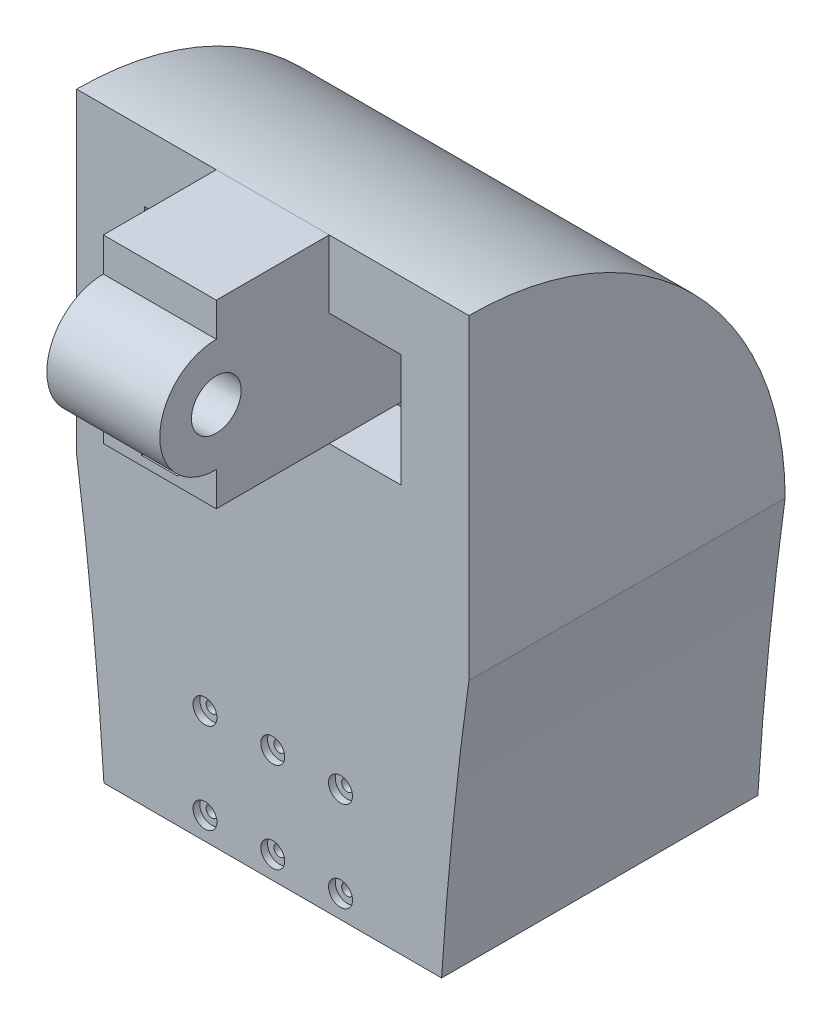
SolidWorks part; units mm, degrees
ref_plane "前视基准面" through (0, 0, 0) normal (0, 0, 1) x (1, 0, 0)
ref_plane "上视基准面" through (0, 0, 0) normal (0, 1, 0) x (1, 0, 0)
ref_plane "右视基准面" through (0, 0, 0) normal (1, 0, 0) x (0, 0, -1)
other "Configuration Table"
sketch "草图2" plane through (0, 0, 0) normal (0, 0, 1) x (1, 0, 0)
  line L1 (0, 0) -> (140, 0)
  line L2 (0, 0) -> (0, 60)
  line L3 (0, 60) -> (140, 60)
  line L4 (140, 0) -> (140, 60)
  line L5 (-30, 110) -> (170, 110)
  line L6 (-30, 110) -> (-30, -3)
  line L7 (-30, -3) -> (170, -3)
  line L8 (170, 110) -> (170, -3)
  dimension "D1" = 140
  dimension "D2" = 60
  dimension "D3" = 30
  dimension "D4" = 30
  dimension "D5" = 50
  dimension "D6" = 3
extrude "凸台-拉伸2" add sketch "草图2" along normal blind 90
sketch "草图4" plane through (0, -3, 0) normal (0, -1, 0) x (1, 0, 0)
  line L4 (-30, 0) -> (170, 0)
  line L5 (170, 0) -> (170, 90)
  line L6 (170, 90) -> (-30, 90)
  line L7 (-30, 90) -> (-30, 0)
  line L8 (-30, 0) -> (170, 0)
  line L9 (170, 0) -> (170, 90)
  line L10 (170, 90) -> (-30, 90)
  line L11 (-30, 90) -> (-30, 0)
  dimension "D1" = 0
extrude "切除-拉伸2" cut sketch "草图4" against normal blind 3
sketch "草图5" plane through (0, 110, 0) normal (0, 1, 0) x (1, 0, 0)
  line L0 (140, -7.5) -> (132.5, -7.5)
  line L1 (132.5, -7.5) -> (132.5, 0)
  line L2 (132.5, -7.5) -> (112.5, -7.5) construction
  line L3 (132.5, -7.5) -> (132.5, -17.5) construction
  line L4 (140, 0) -> (0, 0)
  line L5 (140, -90) -> (140, 0)
  line L6 (0, -90) -> (140, -90)
  line L7 (0, 0) -> (0, -90)
  line L8 (140, 0) -> (0, 0)
  line L9 (140, -90) -> (140, 0)
  line L10 (0, -90) -> (140, -90)
  line L11 (0, 0) -> (0, -90)
  line L12 (70, 0) -> (70, -50000) construction
  circle A0 centre (132.5, -7.5) radius 1.5
  circle A1 centre (112.5, -7.5) radius 1.5
  circle A2 centre (112.5, -17.5) radius 1.5
  circle A3 centre (132.5, -17.5) radius 1.5
  circle A4 centre (27.5, -7.5) radius 1.5
  circle A5 centre (7.5, -7.5) radius 1.5
  circle A6 centre (7.5, -17.5) radius 1.5
  circle A7 centre (27.5, -17.5) radius 1.5
  point P19 (70, 0)
  dimension "D4" = 3
  dimension "D2" = 7.5
  dimension "D3" = 7.5
  dimension "D7" = 20
  dimension "D8" = 10
  dimension "D9" = 20
  dimension "D1" = 0
  dimension "D5" = 2
  dimension "D6" = 2
extrude "切除-拉伸3" cut sketch "草图5" against normal through all contours A6 | A7 | A4 | A5 | A0 | A1 | A2 | A3
sketch "草图6" plane through (0, 0, 0) normal (0, 0, -1) x (-1, 0, 0)
  line L0 (-170, 80) -> (30, 80)
  line L8 (0, 0) -> (30, 0)
  line L9 (30, 0) -> (30, 110)
  line L10 (30, 110) -> (-170, 110)
  line L11 (-170, 110) -> (-170, 0)
  line L12 (-170, 0) -> (-140, 0)
  line L13 (-140, 0) -> (-140, 60)
  line L14 (-140, 60) -> (0, 60)
  line L15 (0, 60) -> (0, 0)
  line L16 (0, 0) -> (30, 0)
  line L17 (30, 0) -> (30, 110)
  line L18 (30, 110) -> (-170, 110)
  line L19 (-170, 110) -> (-170, 0)
  line L20 (-170, 0) -> (-140, 0)
  line L21 (-140, 0) -> (-140, 60)
  line L22 (-140, 60) -> (0, 60)
  line L23 (0, 60) -> (0, 0)
  dimension "D2" = 30
  dimension "D1" = 0
extrude "凸台-拉伸4" add sketch "草图6" along normal blind 50 contours L0 M13 M11 M12
sketch "草图7" plane through (0, 0, -50) normal (0, 0, -1) x (-1, 0, 0)
  line L0 (30, 110) -> (30, 710)
  line L1 (30, 710) -> (-170, 710)
  line L2 (-170, 710) -> (-170, 110)
  line L3 (-70, 710) -> (-70, -49290) construction
  line L4 (-170, 110) -> (-170, 80)
  line L5 (-170, 80) -> (30, 80)
  line L6 (30, 80) -> (30, 110)
  line L7 (30, 110) -> (-170, 110)
  line L8 (-170, 110) -> (-170, 80)
  line L9 (-170, 80) -> (30, 80)
  line L10 (30, 80) -> (30, 110)
  line L11 (30, 110) -> (-170, 110)
  line L12 (-170, 710) -> (-140, 710) construction
  arc A0 (-170, 710) -> (-170, 110) centre (-1741.6234, 410) cw
  arc A1 (30, 710) -> (30, 110) centre (1601.6234, 410) ccw
  arc A2 (-140, 710) -> (-140, 110) centre (-1711.6234, 410) cw
  arc A3 (0, 710) -> (0, 110) centre (1571.6234, 410) ccw
  point P9 (-70, 710)
  dimension "D3" = 1600
  dimension "D2" = 600
  dimension "D5" = 30
  dimension "D1" = 0
  dimension "D4" = 2
extrude "凸台-拉伸5" add sketch "草图7" against normal blind 130 separate body contours A2 L1 A0 L11 | L1 A3 A1 M10
sketch "草图8" plane through (0, 0, -50) normal (0, 0, -1) x (-1, 0, 0)
  line L0 (-170, 110) -> (-170, 410)
  line L1 (-170, 410) -> (-141.6234, 410)
  line L2 (-140, 710) -> (-170, 710)
  line L3 (-170, 110) -> (-140, 110)
  line L4 (-140, 710) -> (-170, 710)
  line L5 (-170, 110) -> (-140, 110)
  line L6 (-140, 710) -> (-10, 710)
  line L7 (-140, 110) -> (0, 110)
  line L9 (30, 710) -> (0, 710)
  line L10 (0, 110) -> (30, 110)
  line L11 (30, 710) -> (0, 710)
  line L12 (0, 110) -> (30, 110)
  arc A2 (-140, 110) -> (-140, 710) centre (-1711.6234, 410) ccw
  arc A3 (-170, 110) -> (-170, 710) centre (-1741.6234, 410) ccw
  arc A4 (-140, 110) -> (-140, 710) centre (-1711.6234, 410) ccw
  arc A5 (-170, 110) -> (-170, 710) centre (-1741.6234, 410) ccw
  arc A6 (0, 710) -> (0, 110) centre (1571.6234, 410) ccw
  arc A7 (30, 710) -> (30, 110) centre (1601.6234, 410) ccw
  arc A8 (0, 710) -> (0, 110) centre (1571.6234, 410) ccw
  arc A9 (30, 710) -> (30, 110) centre (1601.6234, 410) ccw
  dimension "D2" = 0
  dimension "D1" = 0
sketch "草图9" plane through (0, 0, 80) normal (0, 0, 1) x (1, 0, 0)
  line L2 (0, 710) -> (-30, 710)
  line L3 (-30, 110) -> (0, 110)
  line L4 (0, 710) -> (-30, 710)
  line L5 (-30, 110) -> (0, 110)
  line L6 (140, 110) -> (170, 110)
  line L7 (170, 710) -> (140, 710)
  line L8 (140, 110) -> (170, 110)
  line L9 (170, 710) -> (140, 710)
  arc A2 (-30, 110) -> (-30, 710) centre (-1601.6234, 410) ccw
  arc A3 (0, 110) -> (0, 710) centre (-1571.6234, 410) ccw
  arc A4 (-30, 110) -> (-30, 710) centre (-1601.6234, 410) ccw
  arc A5 (0, 110) -> (0, 710) centre (-1571.6234, 410) ccw
  arc A6 (140, 710) -> (140, 110) centre (1711.6234, 410) ccw
  arc A7 (170, 710) -> (170, 110) centre (1741.6234, 410) ccw
  arc A8 (140, 710) -> (140, 110) centre (1711.6234, 410) ccw
  arc A9 (170, 710) -> (170, 110) centre (1741.6234, 410) ccw
  dimension "D1" = 0
  dimension "D2" = 0
extrude "凸台-拉伸6" add sketch "草图9" along normal blind 10
sketch "草图10" plane through (0, 0, 90) normal (0, 0, 1) x (1, 0, 0)
  line L0 (70, 110) -> (70, 310)
  line L1 (140, 110) -> (0, 110) construction
  line L2 (70, 310) -> (70, 450)
  line L3 (70, 450) -> (70, 510)
  line L4 (70, 510) -> (70, 570)
  line L5 (-322.3314, 450) -> (529.2566, 450)
  line L6 (70, 450) -> (-322.3314, 450)
  line L7 (70, 450) -> (70, 110)
  line L8 (70, 110) -> (-322.3314, 110)
  line L9 (-322.3314, 450) -> (-322.3314, 110)
  line L10 (70, 450) -> (529.2566, 450)
  line L11 (70, 450) -> (70, -23.1696)
  line L12 (70, -23.1696) -> (529.2566, -23.1696)
  line L13 (529.2566, 450) -> (529.2566, -23.1696)
  line L14 (-322.3314, 110) -> (-305.3602, 110)
  line L22 (70, 110) -> (-322.3314, 110)
  line L23 (70, 110) -> (70, -23.1696)
  line L24 (70, -23.1696) -> (-322.3314, -23.1696)
  line L25 (-322.3314, 110) -> (-322.3314, -23.1696)
  dimension "D1" = 200
  dimension "D2" = 140
  dimension "D3" = 60
  dimension "D4" = 60
extrude "切除-拉伸8" cut sketch "草图10" against normal blind 150 contours L5 L9 L8 M18 | L5 L0 L2 M16 M15 | L5 L2 L0 M15 M14 | L8 L5 M16 M18 | L11 L5 M15 M8 M9 M10 M11 M12 M14 | L13 L5 L11 L12 M12 M11 M10 M9 M8 | L11 L8 M15 M5 M6 M7 M8
sketch "草图11" plane through (0, 0, 90) normal (0, 0, 1) x (1, 0, 0)
  line L0 (12.8766, 450) -> (12.8766, 510)
  line L1 (-30, 710) -> (-30, 630)
  line L2 (-2.1234, 450) -> (27.8766, 450)
  line L3 (0, 710) -> (-30, 710)
  line L5 (0, 710) -> (-30, 710)
  line L6 (112.1234, 450) -> (142.1234, 450)
  line L7 (170, 710) -> (140, 710)
  line L9 (170, 710) -> (140, 710)
  line L10 (-30, 630) -> (216.8414, 630)
  line L11 (216.8414, 630) -> (216.8414, 710)
  line L12 (216.8414, 710) -> (-30, 710)
  line L17 (-2.1234, 450) -> (27.8766, 450)
  line L18 (112.1234, 450) -> (142.1234, 450)
  arc A2 (-2.1234, 450) -> (-30, 710) centre (-1601.6234, 410) ccw
  arc A3 (27.8766, 450) -> (0, 710) centre (-1571.6234, 410) ccw
  arc A4 (-2.1234, 450) -> (-30, 710) centre (-1601.6234, 410) ccw
  arc A5 (27.8766, 450) -> (0, 710) centre (-1571.6234, 410) ccw
  arc A6 (140, 710) -> (112.1234, 450) centre (1711.6234, 410) ccw
  arc A7 (170, 710) -> (142.1234, 450) centre (1741.6234, 410) ccw
  arc A8 (140, 710) -> (112.1234, 450) centre (1711.6234, 410) ccw
  arc A9 (170, 710) -> (142.1234, 450) centre (1741.6234, 410) ccw
  dimension "D3" = 60
  dimension "D4" = 80
  dimension "D1" = 0
  dimension "D2" = 0
extrude "切除-拉伸9" cut sketch "草图11" against normal blind 140 contours L12 A9 L10 L11 | A9 L9 A8 L10 | A8 L12 L10 M13 | L10 M11 M13 M14
sketch "草图17" plane through (0, 630, 0) normal (0, 1, 0) x (1, 0, 0)
  line L0 (-16.8205, -90) -> (13.1795, -90) construction
  line L1 (-16.8205, 50) -> (-15.8205, 50)
  line L2 (-16.8205, 50) -> (-16.8205, -90)
  line L3 (-16.8205, -90) -> (-15.8205, -90)
  line L4 (-15.8205, 50) -> (-15.8205, -90)
  dimension "D1" = 1
extrude "凸台-拉伸9" add sketch "草图17" along normal blind 10
sketch "草图18" plane through (-15.8205, 0, 0) normal (1, 0, 0) x (0, 0, -1)
  line L0 (-90, 770) -> (-90, 630)
  line L1 (50, 630) -> (-90, 630)
  line L2 (-90, 630) -> (-90, 770)
  line L4 (-90, 630) -> (50, 630)
  line L5 (50, 630) -> (50, 640)
  line L6 (50, 640) -> (-90, 640)
  line L7 (-90, 640) -> (-90, 630)
  line L8 (-90, 630) -> (50, 630)
  line L9 (50, 630) -> (50, 640)
  line L10 (50, 640) -> (-90, 640)
  line L11 (-90, 640) -> (-90, 630)
  arc A0 (50, 630) -> (-90, 770) centre (-90, 630) ccw
  dimension "D2" = 140
  dimension "D1" = 0
extrude "凸台-拉伸10" add sketch "草图18" along normal up to vertex (172.6411 mm away) separate body contours L10 A0 L0 | A0 L10 M5 M8
sketch "草图19" plane through (-15.8205, 0, 0) normal (-1, 0, 0) x (0, 0, 1)
  line L2 (90, 630) -> (90, 770)
  line L3 (-50, 630) -> (90, 630)
  line L4 (90, 630) -> (90, 770)
  line L5 (-50, 630) -> (90, 630)
  arc A1 (90, 770) -> (-50, 630) centre (90, 630) ccw
  arc A2 (90, 770) -> (-50, 630) centre (90, 630) ccw
  dimension "D1" = 0
extrude "凸台-拉伸11" add sketch "草图19" along normal blind 1
sketch "草图21" plane through (-16.8205, 0, 0) normal (-1, 0, 0) x (0, 0, 1)
  line L2 (90, 630) -> (90, 770)
  line L3 (-50, 630) -> (90, 630)
  line L4 (90, 630) -> (90, 770)
  line L5 (-49.6424, 640) -> (-50, 640)
  line L6 (-50, 640) -> (-50, 630)
  line L7 (-50, 630) -> (90, 630)
  line L8 (90, 630) -> (90, 770)
  line L9 (-49.6424, 640) -> (-50, 640)
  line L10 (-50, 640) -> (-50, 630)
  line L11 (-50, 630) -> (90, 630)
  line L12 (90, 630) -> (90, 770)
  line L13 (-50, 630) -> (90, 630)
  arc A1 (90, 770) -> (-49.6424, 640) centre (90, 630) ccw
  arc A2 (90, 770) -> (-49.6424, 640) centre (90, 630) ccw
  arc A3 (90, 770) -> (-50, 630) centre (90, 630) ccw
  arc A4 (90, 770) -> (-50, 630) centre (90, 630) ccw
  dimension "D1" = 0
  dimension "D2" = 0
extrude "切除-拉伸10" cut sketch "草图21" against normal blind 1 contours A4 M11 M12
sketch "草图22" plane through (-16.8205, 0, 0) normal (-1, 0, 0) x (0, 0, 1)
  line L0 (-50, 630) -> (90, 630) construction
  line L1 (90, 770) -> (90, 630) construction
  line L2 (90, 740) -> (90, 630)
  line L3 (90, 630) -> (-20, 630)
  arc A1 (-20, 630) -> (90, 740) centre (90, 630) cw
  dimension "D1" = 30
extrude "切除-拉伸11" cut sketch "草图22" against normal through all from offset 30
sketch "草图26" plane through (156.8205, 0, 0) normal (1, 0, 0) x (0, 0, -1)
  line L4 (-90, 630) -> (50, 630)
  line L5 (-90, 770) -> (-90, 630)
  line L6 (-90, 630) -> (50, 630)
  line L7 (-90, 770) -> (-90, 630)
  arc A2 (50, 630) -> (-90, 770) centre (-90, 630) ccw
  arc A3 (50, 630) -> (-90, 770) centre (-90, 630) ccw
  dimension "D1" = 0
extrude "凸台-拉伸12" add sketch "草图26" against normal blind 30
sketch "草图27" plane through (-16.8205, 0, 0) normal (-1, 0, 0) x (0, 0, 1)
  line L0 (90, 690) -> (-36.4911, 690)
  line L1 (90, 770) -> (140, 770)
  line L2 (-50, 630) -> (90, 630)
  line L3 (90, 630) -> (90, 770)
  line L4 (-50, 630) -> (90, 630)
  line L5 (90, 630) -> (90, 770)
  line L6 (140, 770) -> (140, 690)
  line L8 (140, 690) -> (90, 690)
  arc A0 (140, 770) -> (140, 690) centre (140, 730) cw
  arc A1 (90, 770) -> (-50, 630) centre (90, 630) ccw
  arc A2 (90, 770) -> (-50, 630) centre (90, 630) ccw
  circle A3 centre (140, 730) radius 11
  dimension "D5" = 22
  dimension "D2" = 60
  dimension "D3" = 50
  dimension "D4" = 80
  dimension "D1" = 0
extrude "凸台-拉伸13" add sketch "草图27" against normal mid plane 50 from offset 86.82 contours L0 M7 M5 | A3 L6 L1 L8 M7 | A3 L6 A0
sketch "草图28" plane through (0, 0, -50) normal (0, 0, -1) x (-1, 0, 0)
  line L0 (-112.1234, 450) -> (-27.8766, 450)
  line L1 (-126.8205, 630) -> (-13.1795, 630)
  line L2 (16.8205, 630) -> (-13.1795, 630)
  line L3 (-27.8766, 450) -> (2.1234, 450)
  line L4 (16.8205, 630) -> (-13.1795, 630)
  line L5 (-27.8766, 450) -> (2.1234, 450)
  line L6 (-126.8205, 630) -> (-156.8205, 630)
  line L7 (-142.1234, 450) -> (-112.1234, 450)
  line L8 (-126.8205, 630) -> (-156.8205, 630)
  line L9 (-142.1234, 450) -> (-112.1234, 450)
  arc A2 (16.8205, 630) -> (2.1234, 450) centre (1601.6234, 410) ccw
  arc A3 (-13.1795, 630) -> (-27.8766, 450) centre (1571.6234, 410) ccw
  arc A4 (16.8205, 630) -> (2.1234, 450) centre (1601.6234, 410) ccw
  arc A5 (-13.1795, 630) -> (-27.8766, 450) centre (1571.6234, 410) ccw
  arc A6 (-142.1234, 450) -> (-156.8205, 630) centre (-1741.6234, 410) ccw
  arc A7 (-112.1234, 450) -> (-126.8205, 630) centre (-1711.6234, 410) ccw
  arc A8 (-142.1234, 450) -> (-156.8205, 630) centre (-1741.6234, 410) ccw
  arc A9 (-112.1234, 450) -> (-126.8205, 630) centre (-1711.6234, 410) ccw
  dimension "D1" = 0
  dimension "D2" = 0
extrude "凸台-拉伸14" add sketch "草图28" against normal blind 30 contours A9 L0 L1 M11
sketch "草图29" plane through (0, 0, 90) normal (0, 0, 1) x (1, 0, 0)
  line L0 (12.8766, 450) -> (12.8766, 510)
  line L1 (12.8766, 510) -> (25.2486, 510)
  line L2 (25.2486, 510) -> (-4.7514, 510)
  line L3 (114.7514, 510) -> (144.7514, 510)
  line L4 (44.9995, 690) -> (13.1795, 690)
  line L5 (13.1795, 690) -> (126.8205, 690)
  line L6 (44.9995, 740) -> (44.9995, 770)
  line L7 (44.9995, 770) -> (-16.8205, 770)
  line L8 (-16.8205, 770) -> (-16.8205, 630)
  line L9 (-2.1234, 450) -> (27.8766, 450)
  line L10 (13.1795, 630) -> (13.1795, 740)
  line L11 (13.1795, 740) -> (44.9995, 740)
  line L12 (44.9995, 740) -> (44.9995, 770)
  line L13 (44.9995, 770) -> (-16.8205, 770)
  line L14 (-16.8205, 770) -> (-16.8205, 630)
  line L15 (-2.1234, 450) -> (27.8766, 450)
  line L16 (13.1795, 630) -> (13.1795, 740)
  line L17 (13.1795, 740) -> (44.9995, 740)
  line L18 (27.8766, 450) -> (112.1234, 450)
  line L20 (44.9995, 770) -> (44.9995, 690)
  line L21 (44.9995, 690) -> (94.9995, 690)
  line L22 (156.8205, 770) -> (94.9995, 770)
  line L23 (94.9995, 770) -> (94.9995, 740)
  line L24 (94.9995, 740) -> (126.8205, 740)
  line L25 (126.8205, 740) -> (126.8205, 630)
  line L26 (112.1234, 450) -> (142.1234, 450)
  line L27 (156.8205, 630) -> (156.8205, 770)
  line L28 (156.8205, 770) -> (94.9995, 770)
  line L29 (94.9995, 770) -> (94.9995, 740)
  line L30 (94.9995, 740) -> (126.8205, 740)
  line L31 (126.8205, 740) -> (126.8205, 630)
  line L32 (112.1234, 450) -> (142.1234, 450)
  line L33 (156.8205, 630) -> (156.8205, 770)
  line L34 (94.9995, 690) -> (94.9995, 770)
  line L35 (94.9995, 770) -> (44.9995, 770)
  line L36 (44.9995, 770) -> (44.9995, 690)
  line L37 (44.9995, 690) -> (94.9995, 690)
  line L38 (94.9995, 690) -> (94.9995, 770)
  line L39 (94.9995, 770) -> (44.9995, 770)
  arc A0 (126.8205, 630) -> (112.1234, 450) centre (1711.6234, 410) ccw construction
  arc A1 (156.8205, 630) -> (142.1234, 450) centre (1741.6234, 410) ccw construction
  arc A2 (-2.1234, 450) -> (-16.8205, 630) centre (-1601.6234, 410) ccw
  arc A3 (27.8766, 450) -> (13.1795, 630) centre (-1571.6234, 410) ccw
  arc A4 (-2.1234, 450) -> (-16.8205, 630) centre (-1601.6234, 410) ccw
  arc A5 (27.8766, 450) -> (13.1795, 630) centre (-1571.6234, 410) ccw
  arc A8 (126.8205, 630) -> (112.1234, 450) centre (1711.6234, 410) ccw
  arc A9 (156.8205, 630) -> (142.1234, 450) centre (1741.6234, 410) ccw
  arc A10 (126.8205, 630) -> (112.1234, 450) centre (1711.6234, 410) ccw
  arc A11 (156.8205, 630) -> (142.1234, 450) centre (1741.6234, 410) ccw
  dimension "D2" = 60
  dimension "D1" = 0
  dimension "D3" = 0
  dimension "D4" = 0
sketch "草图30" plane through (0, 0, -20) normal (0, 0, 1) x (1, 0, 0)
  line L0 (70, 450) -> (70, 510)
  line L1 (25.2486, 510) -> (114.7514, 510)
  line L2 (126.8205, 630) -> (13.1795, 630)
  line L3 (27.8766, 450) -> (112.1234, 450)
  line L4 (126.8205, 630) -> (13.1795, 630)
  line L5 (27.8766, 450) -> (112.1234, 450)
  line L6 (40, 510) -> (40, 500)
  line L7 (40, 500) -> (70, 500)
  line L8 (40, 500) -> (70, 500) construction
  line L9 (40, 500) -> (40, 460) construction
  circle A1 centre (40, 500) radius 2.5
  arc A2 (126.8205, 630) -> (112.1234, 450) centre (1711.6234, 410) ccw
  arc A3 (27.8766, 450) -> (13.1795, 630) centre (-1571.6234, 410) ccw
  arc A4 (126.8205, 630) -> (112.1234, 450) centre (1711.6234, 410) ccw
  arc A5 (27.8766, 450) -> (13.1795, 630) centre (-1571.6234, 410) ccw
  circle A6 centre (70, 500) radius 2.5
  circle A7 centre (100, 500) radius 2.5
  circle A8 centre (70, 460) radius 2.5
  circle A9 centre (100, 460) radius 2.5
  circle A10 centre (40, 460) radius 2.5
  dimension "D5" = 5
  dimension "D2" = 60
  dimension "D3" = 10
  dimension "D4" = 30
  dimension "D8" = 90
  dimension "D9" = 40
  dimension "D10" = 30
  dimension "D1" = 0
  dimension "D6" = 3
  dimension "D7" = 2
extrude "切除-拉伸13" cut sketch "草图30" against normal blind 25 and the other way through all contours A1 | A10 | A8 | A6 | A7 | A9
sketch "草图31" plane through (0, 0, -20) normal (0, 0, 1) x (1, 0, 0)
  line L2 (126.8205, 630) -> (13.1795, 630)
  line L3 (27.8766, 450) -> (112.1234, 450)
  line L4 (126.8205, 630) -> (13.1795, 630)
  line L5 (27.8766, 450) -> (112.1234, 450)
  arc A2 (126.8205, 630) -> (112.1234, 450) centre (1711.6234, 410) ccw
  arc A3 (27.8766, 450) -> (13.1795, 630) centre (-1571.6234, 410) ccw
  arc A4 (126.8205, 630) -> (112.1234, 450) centre (1711.6234, 410) ccw
  arc A5 (27.8766, 450) -> (13.1795, 630) centre (-1571.6234, 410) ccw
  dimension "D1" = 0
extrude "切除-拉伸14" cut sketch "草图31" against normal blind 10
extrude "凸台-拉伸15" add sketch "草图29" against normal blind 30 contours A10 L31 L5 L4 L18 M24 M23
sketch "草图33" plane through (0, 0, 60) normal (0, 0, -1) x (-1, 0, 0)
  circle A0 centre (-100, 460) radius 2.5 construction
  circle A1 centre (-100, 500) radius 2.5 construction
  circle A2 centre (-70, 500) radius 2.5 construction
  circle A3 centre (-70, 460) radius 2.5 construction
  circle A4 centre (-40, 460) radius 2.5 construction
  circle A5 centre (-40, 500) radius 2.5 construction
  circle A6 centre (-100, 460) radius 2.5
  circle A7 centre (-100, 500) radius 2.5
  circle A8 centre (-70, 500) radius 2.5
  circle A9 centre (-70, 460) radius 2.5
  circle A10 centre (-40, 460) radius 2.5
  circle A11 centre (-40, 500) radius 2.5
extrude "切除-拉伸15" cut sketch "草图33" against normal blind 25
sketch "草图34" plane through (0, 0, 60) normal (0, 0, -1) x (-1, 0, 0)
  line L2 (-13.1795, 630) -> (-126.8205, 630)
  line L3 (-112.1234, 450) -> (-27.8766, 450)
  line L4 (-13.1795, 630) -> (-126.8205, 630)
  line L5 (-112.1234, 450) -> (-27.8766, 450)
  arc A2 (-112.1234, 450) -> (-126.8205, 630) centre (-1711.6234, 410) ccw
  arc A3 (-13.1795, 630) -> (-27.8766, 450) centre (1571.6234, 410) ccw
  arc A4 (-112.1234, 450) -> (-126.8205, 630) centre (-1711.6234, 410) ccw
  arc A5 (-13.1795, 630) -> (-27.8766, 450) centre (1571.6234, 410) ccw
  dimension "D1" = 0
extrude "切除-拉伸16" cut sketch "草图34" against normal blind 10
sketch "草图35" plane through (-16.8205, 0, 0) normal (-1, 0, 0) x (0, 0, 1)
  line L0 (-50, 510) -> (90, 510)
  line L4 (90, 450) -> (90, 630)
  line L5 (90, 630) -> (-50, 630)
  line L6 (-50, 630) -> (-50, 450)
  line L7 (-50, 450) -> (90, 450)
  line L8 (90, 450) -> (90, 630)
  line L9 (90, 630) -> (-50, 630)
  line L10 (-50, 630) -> (-50, 450)
  line L11 (-50, 450) -> (90, 450)
  dimension "D2" = 60
  dimension "D1" = 0
extrude "切除-拉伸17" cut sketch "草图35" against normal blind 170 contours L10 L11 L8 L0
sketch "草图38" plane through (0, 0, 70) normal (0, 0, -1) x (-1, 0, 0)
  line L2 (-114.7514, 510) -> (-25.2486, 510)
  line L3 (-13.1795, 630) -> (-126.8205, 630)
  line L4 (-114.7514, 510) -> (-25.2486, 510)
  line L5 (-13.1795, 630) -> (-126.8205, 630)
  line L6 (-70, 510) -> (-70, 570)
  line L7 (-70, 570) -> (-100, 570)
  line L8 (-100, 570) -> (-100, 560)
  line L9 (-100, 560) -> (-70, 560) construction
  line L10 (-100, 560) -> (-100, 520) construction
  circle A0 centre (-100, 560) radius 2.5
  circle A1 centre (-70, 560) radius 2.5
  arc A2 (-114.7514, 510) -> (-126.8205, 630) centre (-1711.6234, 410) ccw
  arc A3 (-13.1795, 630) -> (-25.2486, 510) centre (1571.6234, 410) ccw
  arc A4 (-114.7514, 510) -> (-126.8205, 630) centre (-1711.6234, 410) ccw
  arc A5 (-13.1795, 630) -> (-25.2486, 510) centre (1571.6234, 410) ccw
  circle A6 centre (-40, 560) radius 2.5
  circle A7 centre (-70, 520) radius 2.5
  circle A8 centre (-40, 520) radius 2.5
  circle A9 centre (-100, 520) radius 2.5
  dimension "D2" = 60
  dimension "D5" = 5
  dimension "D3" = 30
  dimension "D4" = 10
  dimension "D8" = 90
  dimension "D9" = 30
  dimension "D10" = 40
  dimension "D1" = 0
  dimension "D6" = 3
  dimension "D7" = 2
extrude "切除-拉伸18" cut sketch "草图38" against normal through all both and the other way through all contours A0 | A1 | A6 | A9 | A7 | A8
sketch "草图40" plane through (0, 0, 70) normal (0, 0, -1) x (-1, 0, 0)
  line L0 (-114.7514, 510) -> (-114.7514, 630)
  line L1 (-25.2486, 510) -> (-25.2486, 630)
  line L2 (-114.7514, 510) -> (-25.2486, 510)
  line L3 (-13.1795, 630) -> (-126.8205, 630)
  line L4 (-114.7514, 510) -> (-25.2486, 510)
  line L5 (-13.1795, 630) -> (-126.8205, 630)
  arc A2 (-114.7514, 510) -> (-126.8205, 630) centre (-1711.6234, 410) ccw
  arc A3 (-13.1795, 630) -> (-25.2486, 510) centre (1571.6234, 410) ccw
  arc A4 (-114.7514, 510) -> (-126.8205, 630) centre (-1711.6234, 410) ccw
  arc A5 (-13.1795, 630) -> (-25.2486, 510) centre (1571.6234, 410) ccw
  dimension "D1" = 0
extrude "凸台-拉伸16" add sketch "草图40" along normal blind 10 contours L0 M11 M14 | L1 M13 M14
sketch "草图42" plane through (0, 0, 70) normal (0, 0, -1) x (-1, 0, 0)
  line L0 (-70, 510) -> (-70, 570)
  line L1 (-114.7514, 570) -> (-25.2486, 570)
  line L4 (-25.2486, 630) -> (-114.7514, 630)
  line L5 (-114.7514, 630) -> (-114.7514, 510)
  line L6 (-114.7514, 510) -> (-25.2486, 510)
  line L7 (-25.2486, 510) -> (-25.2486, 630)
  line L8 (-25.2486, 630) -> (-114.7514, 630)
  line L9 (-114.7514, 630) -> (-114.7514, 510)
  line L10 (-114.7514, 510) -> (-25.2486, 510)
  line L11 (-25.2486, 510) -> (-25.2486, 630)
  dimension "D2" = 60
  dimension "D1" = 0
extrude "凸台-拉伸17" add sketch "草图42" along normal blind 10 contours L1 M13 M15 M12
sketch "草图43" plane through (0, 0, -30) normal (0, 0, 1) x (1, 0, 0)
  line L0 (70, 510) -> (70, 570)
  line L1 (25.2486, 510) -> (25.2486, 630)
  line L2 (25.2486, 510) -> (114.7514, 510)
  line L3 (126.8205, 630) -> (13.1795, 630)
  line L4 (25.2486, 510) -> (114.7514, 510)
  line L5 (126.8205, 630) -> (13.1795, 630)
  line L6 (114.7514, 510) -> (114.7514, 630)
  line L7 (20.3451, 570.1138) -> (119.6549, 570.1138)
  arc A2 (25.2486, 510) -> (13.1795, 630) centre (-1571.6234, 410) ccw
  arc A3 (126.8205, 630) -> (114.7514, 510) centre (1711.6234, 410) ccw
  arc A4 (25.2486, 510) -> (13.1795, 630) centre (-1571.6234, 410) ccw
  arc A5 (126.8205, 630) -> (114.7514, 510) centre (1711.6234, 410) ccw
  dimension "D2" = 60
  dimension "D1" = 0
extrude "凸台-拉伸18" add sketch "草图43" along normal blind 10 contours L7 L1 M12 M15 | L7 L1 M12 | L1 L7 L6 L5 | L6 L7 M14 M15 | L7 L6 M14
sketch "草图44" plane through (44.9995, 0, 0) normal (-1, 0, 0) x (0, 0, 1)
  line L0 (140, 770) -> (140, 755)
  line L1 (140, 690) -> (140, 705)
  line L5 (140, 770) -> (90, 770)
  line L6 (90, 770) -> (90, 740)
  line L7 (-2.1954, 690) -> (60, 690)
  line L8 (60, 690) -> (90, 690)
  line L9 (90, 690) -> (140, 690)
  line L10 (140, 770) -> (90, 770)
  line L11 (90, 770) -> (90, 740)
  line L12 (-2.1954, 690) -> (60, 690)
  line L13 (60, 690) -> (90, 690)
  line L14 (90, 690) -> (140, 690)
  arc A0 (140, 705) -> (140, 755) centre (140, 730) ccw
  arc A2 (90, 740) -> (-2.1954, 690) centre (90, 630) ccw
  arc A3 (140, 690) -> (140, 770) centre (140, 730) ccw
  arc A4 (90, 740) -> (-2.1954, 690) centre (90, 630) ccw
  arc A5 (140, 690) -> (140, 770) centre (140, 730) ccw
  dimension "D2" = 15
  dimension "D3" = 15
  dimension "D1" = 0
extrude "切除-拉伸20" cut sketch "草图44" against normal blind 70 contours A0 L1 L0 M17
sketch "草图45" plane through (0, 0, -50) normal (0, 0, -1) x (-1, 0, 0)
  line L0 (-25.2486, 510) -> (-25.2486, 570) construction
  line L1 (-25.2486, 570) -> (-114.7514, 570) construction
  line L2 (-114.7514, 570) -> (-114.7514, 510) construction
  line L3 (-114.7514, 510) -> (-25.2486, 510) construction
  line L4 (-144.7514, 510) -> (4.7514, 510) construction
  line L5 (16.8205, 630) -> (-156.8205, 630) construction
  line L6 (-25.2486, 510) -> (-25.2486, 570)
  line L7 (-25.2486, 570) -> (-114.7514, 570)
  line L8 (-114.7514, 570) -> (-114.7514, 510)
  line L9 (-114.7514, 510) -> (-25.2486, 510)
  line L10 (-144.7514, 510) -> (4.7514, 510)
  line L11 (16.8205, 630) -> (-156.8205, 630)
  arc A0 (-144.7514, 510) -> (-156.8205, 630) centre (-1741.6234, 410) ccw construction
  arc A1 (16.8205, 630) -> (4.7514, 510) centre (1601.6234, 410) ccw construction
  circle A2 centre (-100, 560) radius 2.5 construction
  arc A3 (-144.7514, 510) -> (-156.8205, 630) centre (-1741.6234, 410) ccw
  arc A4 (16.8205, 630) -> (4.7514, 510) centre (1601.6234, 410) ccw
  circle A5 centre (-100, 560) radius 2.5
  circle A6 centre (-70, 560) radius 2.5 construction
  circle A7 centre (-70, 560) radius 2.5
  circle A8 centre (-100, 520) radius 2.5 construction
  circle A9 centre (-70, 520) radius 2.5 construction
  circle A10 centre (-40, 520) radius 2.5 construction
  circle A11 centre (-40, 560) radius 2.5 construction
  circle A12 centre (-100, 520) radius 2.5
  circle A13 centre (-70, 520) radius 2.5
  circle A14 centre (-40, 520) radius 2.5
  circle A15 centre (-40, 560) radius 2.5
  circle A16 centre (-100, 560) radius 5.3
  circle A17 centre (-70, 560) radius 5.3
  circle A18 centre (-40, 560) radius 5.3
  circle A19 centre (-100, 520) radius 5.3
  circle A20 centre (-70, 520) radius 5.3
  circle A21 centre (-40, 520) radius 5.3
  dimension "D1" = 10.6
  dimension "D2" = 10.6
  dimension "D3" = 10.6
  dimension "D4" = 10.6
  dimension "D5" = 10.6
  dimension "D6" = 10.6
extrude "切除-拉伸21" cut sketch "草图45" against normal blind 3 contours A16 M7 | A17 M2 | A18 M3 | A21 M6 | A20 M5 | A19 M4
sketch "草图46" plane through (0, 0, 90) normal (0, 0, 1) x (1, 0, 0)
  line L14 (-4.7514, 510) -> (144.7514, 510)
  line L15 (156.8205, 630) -> (156.8205, 770)
  line L16 (156.8205, 770) -> (94.9995, 770)
  line L17 (94.9995, 770) -> (94.9995, 740)
  line L18 (94.9995, 740) -> (126.8205, 740)
  line L19 (126.8205, 740) -> (126.8205, 690)
  line L20 (126.8205, 690) -> (94.9995, 690)
  line L21 (94.9995, 690) -> (44.9995, 690)
  line L22 (44.9995, 690) -> (13.1795, 690)
  line L23 (13.1795, 690) -> (13.1795, 740)
  line L24 (13.1795, 740) -> (44.9995, 740)
  line L25 (44.9995, 740) -> (44.9995, 770)
  line L26 (44.9995, 770) -> (-16.8205, 770)
  line L27 (-16.8205, 770) -> (-16.8205, 630)
  line L28 (-4.7514, 510) -> (144.7514, 510)
  line L29 (156.8205, 630) -> (156.8205, 770)
  line L30 (156.8205, 770) -> (94.9995, 770)
  line L31 (94.9995, 770) -> (94.9995, 740)
  line L32 (94.9995, 740) -> (126.8205, 740)
  line L33 (126.8205, 740) -> (126.8205, 690)
  line L34 (126.8205, 690) -> (94.9995, 690)
  line L35 (94.9995, 690) -> (44.9995, 690)
  line L36 (44.9995, 690) -> (13.1795, 690)
  line L37 (13.1795, 690) -> (13.1795, 740)
  line L38 (13.1795, 740) -> (44.9995, 740)
  line L39 (44.9995, 740) -> (44.9995, 770)
  line L40 (44.9995, 770) -> (-16.8205, 770)
  line L41 (-16.8205, 770) -> (-16.8205, 630)
  circle A0 centre (40, 520) radius 2.5 construction
  circle A1 centre (70, 520) radius 2.5 construction
  arc A2 (-4.7514, 510) -> (-16.8205, 630) centre (-1601.6234, 410) ccw
  arc A3 (156.8205, 630) -> (144.7514, 510) centre (1741.6234, 410) ccw
  arc A4 (-4.7514, 510) -> (-16.8205, 630) centre (-1601.6234, 410) ccw
  arc A5 (156.8205, 630) -> (144.7514, 510) centre (1741.6234, 410) ccw
  circle A6 centre (100, 520) radius 2.5 construction
  circle A7 centre (100, 560) radius 2.5 construction
  circle A8 centre (70, 560) radius 2.5 construction
  circle A9 centre (40, 560) radius 2.5 construction
  circle A10 centre (40, 520) radius 2.5
  circle A11 centre (70, 520) radius 2.5
  circle A12 centre (100, 520) radius 2.5
  circle A13 centre (100, 560) radius 2.5
  circle A14 centre (70, 560) radius 2.5
  circle A15 centre (40, 560) radius 2.5
  circle A16 centre (40, 560) radius 5.3
  circle A17 centre (70, 560) radius 5.3
  circle A18 centre (100, 560) radius 5.3
  circle A19 centre (40, 520) radius 5.3
  circle A20 centre (70, 520) radius 5.3
  circle A21 centre (100, 520) radius 5.3
  dimension "D2" = 10.6
  dimension "D3" = 10.6
  dimension "D4" = 10.6
  dimension "D5" = 10.6
  dimension "D6" = 10.6
  dimension "D7" = 10.6
  dimension "D1" = 0
extrude "切除-拉伸23" cut sketch "草图46" against normal blind 3 contours A16 M18 | A17 M17 | A18 M22 | A21 M19 | A20 M20 | A19 M21
ref_plane "基准面1" through (44.9995, 705, 140) normal (0, 1, 0) x (1, 0, 0)
sketch "草图48" plane through (0, 0, 140) normal (0, 0, 1) x (1, 0, 0)
  line L0 (69.9995, 690) -> (69.9995, 694)
  line L1 (69.9995, 694) -> (61.9995, 694)
  line L2 (61.9995, 694) -> (61.9995, 701)
  line L3 (61.9995, 701) -> (77.9995, 701)
  line L4 (94.9995, 690) -> (94.9995, 705)
  line L5 (94.9995, 705) -> (44.9995, 705)
  line L6 (44.9995, 705) -> (44.9995, 690)
  line L7 (44.9995, 690) -> (94.9995, 690)
  line L8 (94.9995, 690) -> (94.9995, 705)
  line L9 (94.9995, 705) -> (44.9995, 705)
  line L10 (44.9995, 705) -> (44.9995, 690)
  line L11 (44.9995, 690) -> (94.9995, 690)
  line L12 (77.9995, 701) -> (77.9995, 694)
  line L13 (77.9995, 694) -> (69.9995, 694)
  dimension "D2" = 7
  dimension "D3" = 4
  dimension "D4" = 8
  dimension "D5" = 8
  dimension "D1" = 0
extrude "切除-拉伸24" cut sketch "草图48" against normal blind 100 contours L13 L12 L3 L2 L1
sketch "草图49" plane through (0, 690, 0) normal (0, -1, 0) x (1, 0, 0)
  line L0 (69.9995, 60) -> (69.9995, 40)
  line L1 (69.9995, 40) -> (77.9995, 40)
  line L2 (77.9995, 40) -> (77.9995, 60)
  line L3 (77.9995, 60) -> (61.9995, 60)
  line L4 (94.9995, 60) -> (44.9995, 60)
  line L5 (44.9995, 60) -> (44.9995, -2.1954)
  line L6 (44.9995, -2.1954) -> (94.9995, -2.1954)
  line L7 (94.9995, -2.1954) -> (94.9995, 60)
  line L8 (94.9995, 60) -> (44.9995, 60)
  line L9 (44.9995, 60) -> (44.9995, -2.1954)
  line L10 (44.9995, -2.1954) -> (94.9995, -2.1954)
  line L11 (94.9995, -2.1954) -> (94.9995, 60)
  line L12 (61.9995, 60) -> (61.9995, 40)
  line L13 (61.9995, 40) -> (69.9995, 40)
  dimension "D2" = 20
  dimension "D3" = 16
  dimension "D4" = 8
  dimension "D1" = 0
extrude "切除-拉伸25" cut sketch "草图49" against normal up to surface (11 mm away) contours L1 L2 L0 M9 | L12 L13 L0 M9
